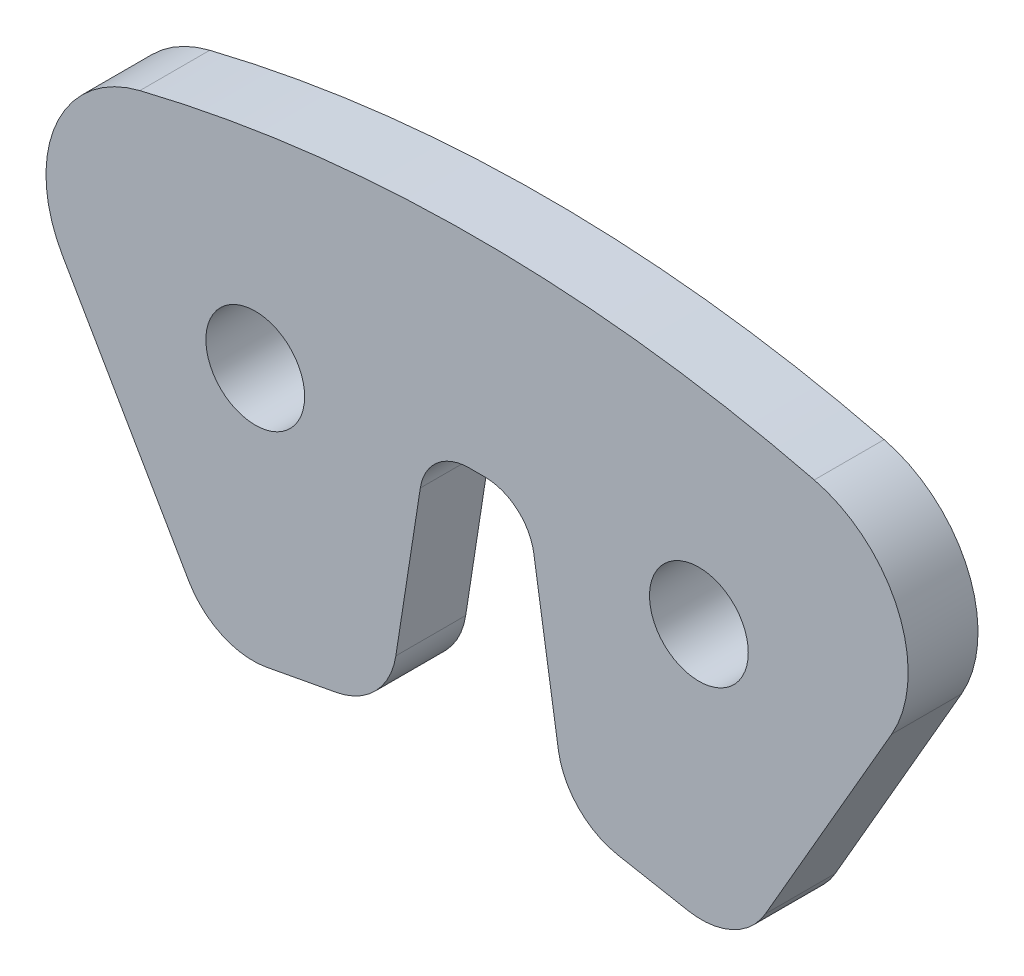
SolidWorks part; units mm, degrees
ref_plane "前视基准面" through (0, 0, 0) normal (0, 0, 1) x (1, 0, 0)
ref_plane "上视基准面" through (0, 0, 0) normal (0, 1, 0) x (1, 0, 0)
ref_plane "右视基准面" through (0, 0, 0) normal (1, 0, 0) x (0, 0, -1)
sketch "草图1" plane through (0, 0, 0) normal (0, 0, 1) x (1, 0, 0)
  line L0 (-4.7625, 25.4771) -> (-8.3344, 25.4771) construction
  line L1 (0, 0) -> (0, 17) construction
  line L2 (-4.7625, 25.4771) -> (4.7625, 25.4771) construction
  line L3 (0, 17) -> (0, 32.8717) construction
  line L4 (0, 10.0845) -> (-10.5604, 28.3757) construction
  line L5 (0, 10.0845) -> (8.1199, 24.1485) construction
  line L6 (0, 32.8717) -> (2.7877, 14.9129) construction
  line L7 (0, 32.8717) -> (-2.7877, 14.9129) construction
  line L8 (0, 0) -> (-4.7625, 25.4771) construction
  line L9 (0, 0) -> (4.7625, 25.4771) construction
  line L10 (4.7625, 25.4771) -> (19.0427, 25.4771) construction
  line L11 (1.9167, 20.5239) -> (5.6268, 19.8304)
  line L12 (0, 0) -> (28.5, 0) construction
  line L13 (28.5, 0) -> (30, 0) construction
  line L14 (-11.6582, 30.2771) -> (11.6582, 30.2771) construction
  line L15 (-10.5604, 28.3757) -> (-11.6582, 30.2771) construction
  line L16 (8.1199, 24.1485) -> (11.6582, 30.2771) construction
  line L17 (-1.9167, 20.5239) -> (-5.6268, 19.8304)
  circle A0 centre (0, 0) radius 25.9184
  circle A1 centre (0, 0) radius 25.4771
  circle A3 centre (-4.7625, 25.4771) radius 3.5719
  circle A4 centre (4.7625, 25.4771) radius 3.5719
  circle A6 centre (0, 0) radius 30.2771
  circle A7 centre (-4.7625, 25.4771) radius 1.06
  circle A8 centre (4.7625, 25.4771) radius 1.06
  point P21 (3.7718, 20.1771)
  dimension "d" = 51.8369
  dimension "da" = 50.9542
  dimension "D2" = 2.12
  dimension "p" = 9.525
  dimension "Z" = 17
  dimension "rd" = 3.5719
  dimension "α" = 60
  dimension "γ" = 8.824
  dimension "φ" = 21.176
  dimension "β" = 19.412
  dimension "b" = 28.5
  dimension "δ" = 1.5
  dimension "H" = 10.1
  dimension "h1" = 5.3
sketch "草图2" plane through (0, 0, 0) normal (0, 0, 1) x (1, 0, 0)
  line L0 (1.9167, 20.5239) -> (5.6268, 19.8304) construction
  line L1 (-1.9167, 20.5239) -> (-5.6268, 19.8304) construction
  line L2 (0, 10.0845) -> (8.1199, 24.1485) construction
  line L3 (0, 32.8717) -> (2.7877, 14.9129) construction
  line L4 (0, 32.8717) -> (-2.7877, 14.9129) construction
  line L5 (0, 10.0845) -> (-10.5604, 28.3757) construction
  line L6 (1.9167, 20.5239) -> (5.6268, 19.8304)
  line L7 (-1.9167, 20.5239) -> (-5.6268, 19.8304)
  line L8 (5.6268, 19.8304) -> (8.1199, 24.1485)
  line L9 (1.0829, 25.8958) -> (1.9167, 20.5239)
  line L10 (-1.0829, 25.8958) -> (-1.9167, 20.5239)
  line L11 (-5.6268, 19.8304) -> (-10.5604, 28.3757)
  line L12 (8.1199, 24.1485) -> (11.6582, 30.2771) construction
  line L13 (8.1199, 24.1485) -> (10.5604, 28.3757)
  circle A0 centre (-4.7625, 25.4771) radius 1.06 construction
  circle A1 centre (4.7625, 25.4771) radius 1.06 construction
  circle A2 centre (0, 0) radius 30.2771 construction
  circle A3 centre (-4.7625, 25.4771) radius 1.06
  circle A4 centre (4.7625, 25.4771) radius 1.06
  arc A5 (10.5604, 28.3757) -> (-10.5604, 28.3757) centre (0, 0) ccw
  arc A8 (1.0829, 25.8958) -> (-1.0829, 25.8958) centre (0, 0) ccw
  circle A10 centre (0, 0) radius 25.9184 construction
extrude "拉伸1" add sketch "草图2" along normal mid plane 1.5
fillet "圆角1" radius 2.65 2 edges at (10.5604, 28.3757, 0) (-10.5604, 28.3757, 0)
fillet "圆角2" radius 1.59 4 edges at (5.6268, 19.8304, 0) (1.9167, 20.5239, 0) (-1.9167, 20.5239, 0) (-5.6268, 19.8304, 0)
fillet "圆角3" radius 1.06 2 edges at (1.0829, 25.8958, 0) (-1.0829, 25.8958, 0)
equation "\"d@草图1\" = \"p@草图1\" /  sin( 180 / \"Z@草图1\" ) "
equation "\"da@草图1\" = \"p@草图1\" /  tan( 180 / \"Z@草图1\" ) "
equation "\"rd@草图1\" = 0.375 * \"p@草图1\""
equation "\"γ@草图1\" = 30 - 360 / \"Z@草图1\""
equation "\"φ@草图1\" = 360 / \"Z@草图1\""
equation "\"D1@拉伸1\" = \"δ@草图1\""
equation "\"D1@圆角1\" = \"h1@草图1\" / 2"
equation "\"D1@圆角2\" = \"D1@圆角1\" * 0.6"
equation "\"D1@圆角3\" = \"D1@圆角2\" * 2 / 3"
equation "\"D2@草图1\" = \"D1@圆角1\" * 0.8"
